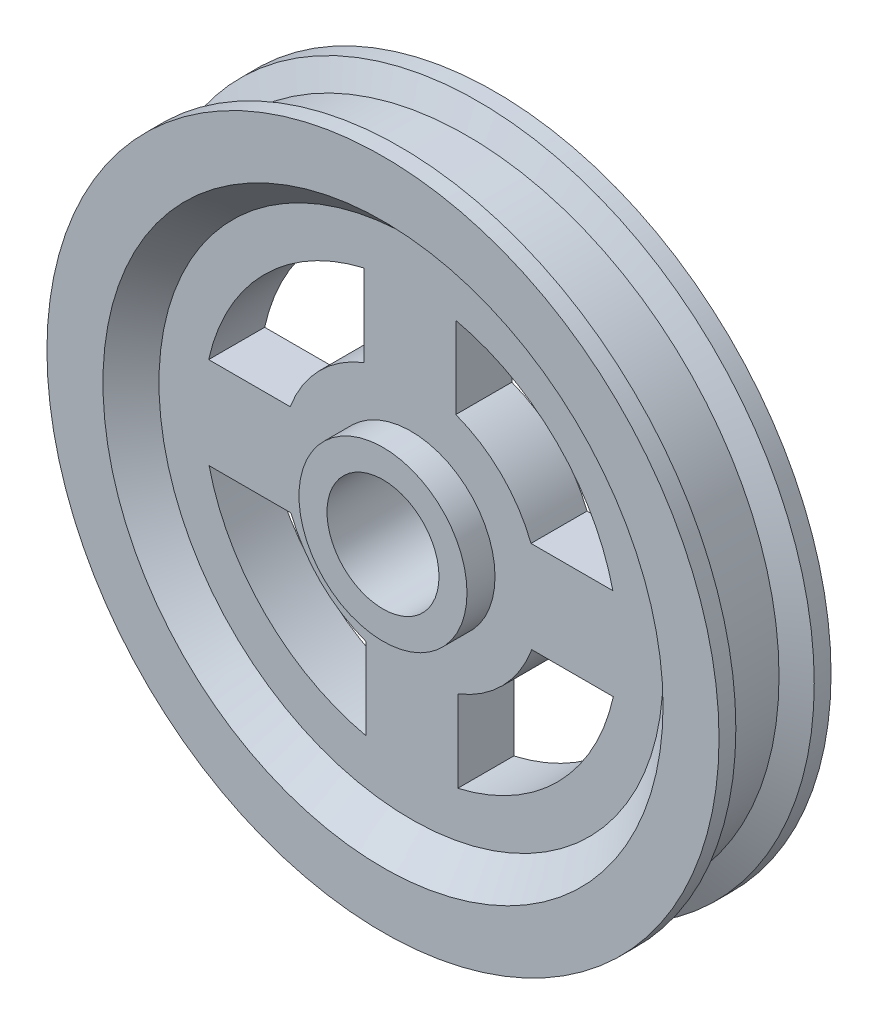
SolidWorks part; units mm, degrees
ref_plane "Front Plane" through (0, 0, 0) normal (0, 0, 1) x (1, 0, 0)
ref_plane "Top Plane" through (0, 0, 0) normal (0, 1, 0) x (1, 0, 0)
ref_plane "Right Plane" through (0, 0, 0) normal (1, 0, 0) x (0, 0, -1)
sketch "Sketch1" plane through (0, 0, 0) normal (1, 0, 0) x (0, 0, -1)
  line L0 (-5, 15) -> (-5, 45)
  line L1 (-10, 15) -> (-5, 15)
  line L2 (-10, 15) -> (-10, 10)
  line L3 (-10, 10) -> (10, 10)
  line L4 (10, 15) -> (10, 10)
  line L5 (-5, 45) -> (-10, 50)
  line L6 (-10, 50) -> (-10, 60)
  line L7 (-10, 60) -> (-7, 60)
  line L8 (-7, 60) -> (-5, 55.711)
  line L9 (-5, 55.711) -> (5, 55.711)
  line L10 (0, 0) -> (0, 90.3055) construction
  line L11 (5, 15) -> (5, 45)
  line L12 (5, 45) -> (10, 50)
  line L13 (10, 50) -> (10, 60)
  line L14 (10, 60) -> (7, 60)
  line L15 (7, 60) -> (5, 55.711)
  line L16 (5, 15) -> (10, 15)
  line L17 (-25.7403, 0) -> (39.5675, 0) construction
  dimension "D1" = 50
  dimension "D2" = 20
  dimension "D3" = 135
  dimension "D4" = 10
  dimension "D5" = 3
  dimension "D6" = 10
  dimension "D7" = 115
  dimension "D8" = 10
  dimension "D9" = 5
  dimension "D10" = 30
  dimension "D11" = 10
revolve "Revolve1" add sketch "Sketch1" angle 360 about L17
sketch "Sketch2" plane through (0, 0, -5) normal (0, 0, -1) x (-1, 0, 0)
  line L7 (-36.0442, 8.3554) -> (-21.4287, 8.3554)
  line L8 (-8, 21.5639) -> (-8, 36.1248)
  circle A2 centre (0, 0) radius 45 construction
  arc A11 (-8, 21.5639) -> (-21.4287, 8.3554) centre (0, 0) ccw
  arc A12 (-8, 36.1248) -> (-36.0442, 8.3554) centre (0, 0) ccw
  dimension "D1" = 37
  dimension "D2" = 23
extrude "Cut-Extrude1" cut sketch "Sketch2" against normal blind 10
pattern_circular "CirPattern1" count 4 over 360 about axis through (0, 0, 0) along (0, 0, 1) of "Cut-Extrude1"
